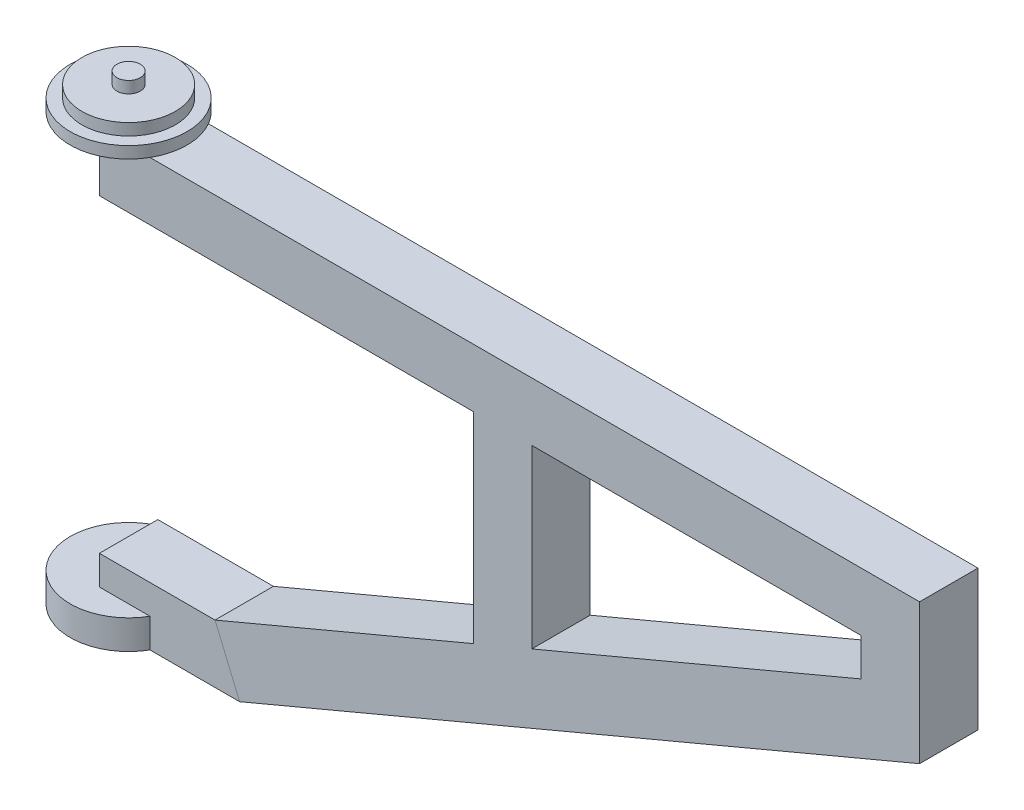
SolidWorks part; units mm, degrees
ref_plane "Front Plane" through (0, 0, 0) normal (0, 0, 1) x (1, 0, 0)
ref_plane "Top Plane" through (0, 0, 0) normal (0, 1, 0) x (1, 0, 0)
ref_plane "Right Plane" through (0, 0, 0) normal (1, 0, 0) x (0, 0, -1)
sketch "Sketch1" plane through (0, 0, 0) normal (0, 1, 0) x (1, 0, 0)
  circle A0 centre (0, 0) radius 12.7
  dimension "D1" = 25.4
extrude "Boss-Extrude1" add sketch "Sketch1" against normal blind 12.7
sketch "Sketch2" plane through (0, -12.7, 0) normal (0, -1, 0) x (1, 0, 0)
  circle A0 centre (0, 0) radius 50.8
  dimension "D1" = 101.6
extrude "Boss-Extrude2" add sketch "Sketch2" along normal blind 12.7
sketch "Sketch3" plane through (0, -25.4, 0) normal (0, -1, 0) x (1, 0, 0)
  circle A0 centre (0, 0) radius 63.5
  dimension "D1" = 127
extrude "Boss-Extrude3" add sketch "Sketch3" along normal blind 12.7
ref_plane "Plane1" through (0, -501.65, 0) normal (0, -1, 0) x (-1, 0, 0)
sketch "Sketch5" plane through (0, -501.65, 0) normal (0, -1, 0) x (-1, 0, 0)
  circle A0 centre (0, 0) radius 63.5
  circle A1 centre (0, 0) radius 63.5 construction
extrude "Boss-Extrude5" add sketch "Sketch5" against normal blind 31.75 separate body contours A0
sketch "Sketch6" plane through (0, -501.65, 0) normal (0, -1, 0) x (1, 0, 0)
  line L0 (0, -63.5) -> (0, -31.75) construction
  line L1 (0, 31.75) -> (891.3918, 31.75)
  line L2 (0, 31.75) -> (0, -31.75)
  line L3 (0, -31.75) -> (891.3918, -31.75)
  line L4 (891.3918, 31.75) -> (891.3918, -31.75)
  point P2 (0, 0)
  point P4 (0, -31.75)
  point P12 (0, 0)
  dimension "D1" = 891.3918
  dimension "D2" = 63.5
extrude "Boss-Extrude6" add sketch "Sketch6" against normal blind 63.5
sketch "Sketch7" plane through (0, -38.1, 0) normal (0, -1, 0) x (1, 0, 0)
  line L0 (0, -31.75) -> (0, -63.5) construction
  line L1 (0, -31.75) -> (891.3918, -31.75)
  line L2 (0, -31.75) -> (0, 31.75)
  line L3 (0, 31.75) -> (891.3918, 31.75)
  line L4 (891.3918, -31.75) -> (891.3918, 31.75)
  line L5 (0, 31.75) -> (0, -31.75) construction
  point P0 (0, 0)
  point P4 (0, 0)
  dimension "D2" = 891.3918
extrude "Boss-Extrude7" add sketch "Sketch7" along normal blind 63.5
sketch "Sketch8" plane through (0, 0, -31.75) normal (0, 0, -1) x (-1, 0, 0)
  line L0 (-54.9926, -501.65) -> (-891.3918, -501.65) construction
  line L1 (-891.3918, -38.1) -> (-827.8918, -38.1)
  line L2 (-891.3918, -38.1) -> (-891.3918, -501.65)
  line L3 (-891.3918, -501.65) -> (-827.8918, -501.65)
  line L4 (-827.8918, -38.1) -> (-827.8918, -501.65)
  dimension "D1" = 63.5
extrude "Boss-Extrude8" add sketch "Sketch8" against normal up to vertex (63.5 mm away)
sketch "Sketch9" plane through (0, 0, -31.75) normal (0, 0, -1) x (-1, 0, 0)
  line L0 (-54.9926, -38.1) -> (-891.3918, -38.1) construction
  line L1 (-406.4, -38.1) -> (-469.9, -38.1)
  line L2 (-406.4, -38.1) -> (-406.4, -501.65)
  line L3 (-406.4, -501.65) -> (-469.9, -501.65)
  line L4 (-469.9, -38.1) -> (-469.9, -501.65)
  line L5 (-54.9926, -501.65) -> (-891.3918, -501.65) construction
  dimension "D1" = 63.5
  dimension "D2" = 406.4
extrude "Boss-Extrude9" add sketch "Sketch9" against normal blind 63.5
sketch "Sketch10" plane through (0, 0, 31.75) normal (0, 0, 1) x (1, 0, 0)
  line L0 (152.4, -501.65) -> (891.3918, -190.5)
  line L1 (891.3918, -501.65) -> (54.9926, -501.65) construction
  line L2 (891.3918, -38.1) -> (891.3918, -501.65) construction
  line L3 (891.3918, -190.5) -> (891.3918, -501.65)
  line L4 (891.3918, -501.65) -> (152.4, -501.65)
  line L5 (0, -438.15) -> (0, -469.9) construction
  line L6 (54.9926, -38.1) -> (891.3918, -38.1) construction
  dimension "D1" = 152.4
  dimension "D2" = 152.4
extrude "Cut-Extrude1" cut sketch "Sketch10" against normal through all
sketch "Sketch11" plane through (0, 0, 31.75) normal (0, 0, 1) x (1, 0, 0)
  line L0 (891.3918, -190.5) -> (864.6553, -127)
  line L1 (864.6553, -127) -> (125.6635, -438.15)
  line L2 (303.2146, -438.15) -> (0, -438.15) construction
  line L3 (125.6635, -438.15) -> (152.4, -501.65)
  line L4 (469.9, -367.9677) -> (406.4, -394.7042) construction
  line L5 (891.3918, -190.5) -> (152.4, -501.65)
extrude "Boss-Extrude10" add sketch "Sketch11" against normal up to surface (63.5 mm away)
